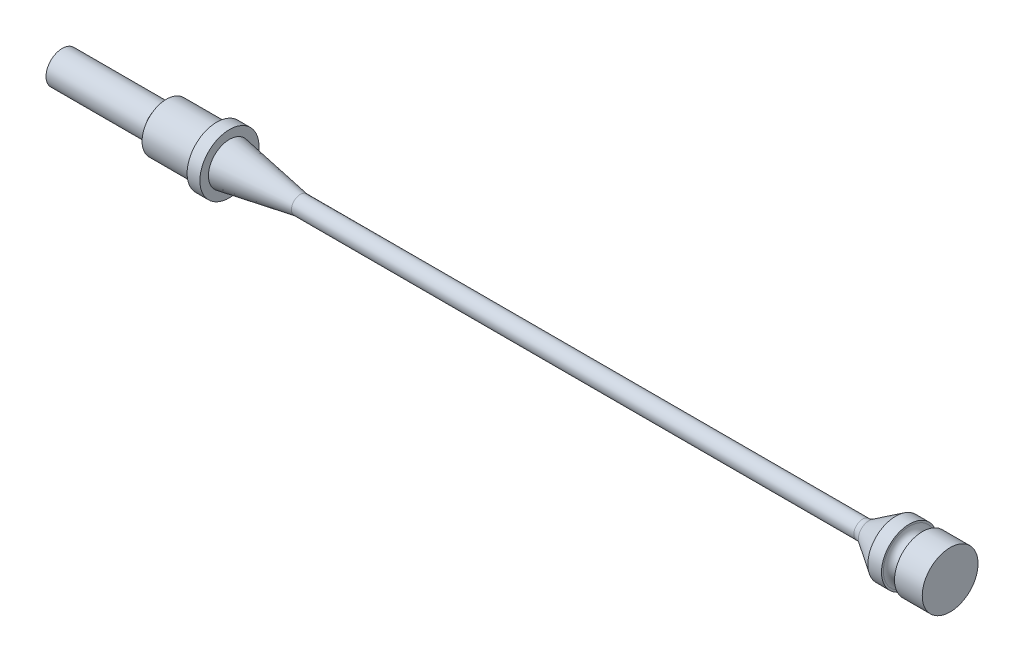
SolidWorks part; units mm, degrees
ref_plane "Front Plane" through (0, 0, 0) normal (0, 0, 1) x (1, 0, 0)
ref_plane "Top Plane" through (0, 0, 0) normal (0, 1, 0) x (1, 0, 0)
ref_plane "Right Plane" through (0, 0, 0) normal (1, 0, 0) x (0, 0, -1)
sketch "Sketch2" plane through (0, 0, 0) normal (0, 0, 1) x (1, 0, 0)
  line L0 (0, 0) -> (190.5, 0) construction
  line L1 (190.5, 0) -> (190.5, 5.988)
  line L2 (190.5, 5.988) -> (184.5564, 5.988)
  line L3 (171.7326, 1.905) -> (51.0826, 1.905)
  line L4 (184.5564, 5.988) -> (184.5564, 5.588)
  line L5 (181.7624, 5.588) -> (181.7624, 5.988)
  line L6 (181.7624, 5.988) -> (178.8287, 5.988)
  line L7 (178.8287, 5.988) -> (173.1063, 2.3085)
  line L8 (33.1343, 5.226) -> (22.352, 5.226)
  line L9 (22.352, 5.226) -> (21.082, 3.4862)
  line L10 (0, 0) -> (0, 3.4862)
  line L11 (0, 3.4862) -> (21.082, 3.4862)
  line L12 (33.1343, 5.226) -> (33.1343, 6.35)
  line L13 (33.1343, 6.35) -> (35.8775, 6.35)
  line L14 (35.8775, 6.35) -> (35.8775, 4.5149)
  line L15 (35.8775, 4.5149) -> (51.0826, 1.905)
  line L16 (0, 0) -> (190.5, 0)
  arc A0 (181.7624, 5.588) -> (184.5564, 5.588) centre (183.1594, 5.588) ccw
  arc A1 (173.1063, 2.3085) -> (171.7326, 1.905) centre (171.7326, 4.445) cw
  point P12 (172.4787, 1.905)
  point P15 (172.4787, 1.905)
  point P18 (33.1343, 5.226)
  dimension "D6" = 1.397
  dimension "D10" = 2.54
  dimension "D1" = 190.5
  dimension "D2" = 5.988
  dimension "D3" = 5.9436
  dimension "D4" = 2.794
  dimension "D5" = 0.4001
  dimension "D7" = 2.9337
  dimension "D8" = 3.81
  dimension "D9" = 6.35
  dimension "D11" = 120.65
  dimension "D12" = 33.1343
  dimension "D13" = 21.082
  dimension "D14" = 5.226
  dimension "D15" = 10.7823
  dimension "D16" = 3.4861
  dimension "D17" = 6.35
  dimension "D18" = 2.7432
  dimension "D19" = 4.5149
revolve "Revolve2" add sketch "Sketch2" angle 360 about L0
